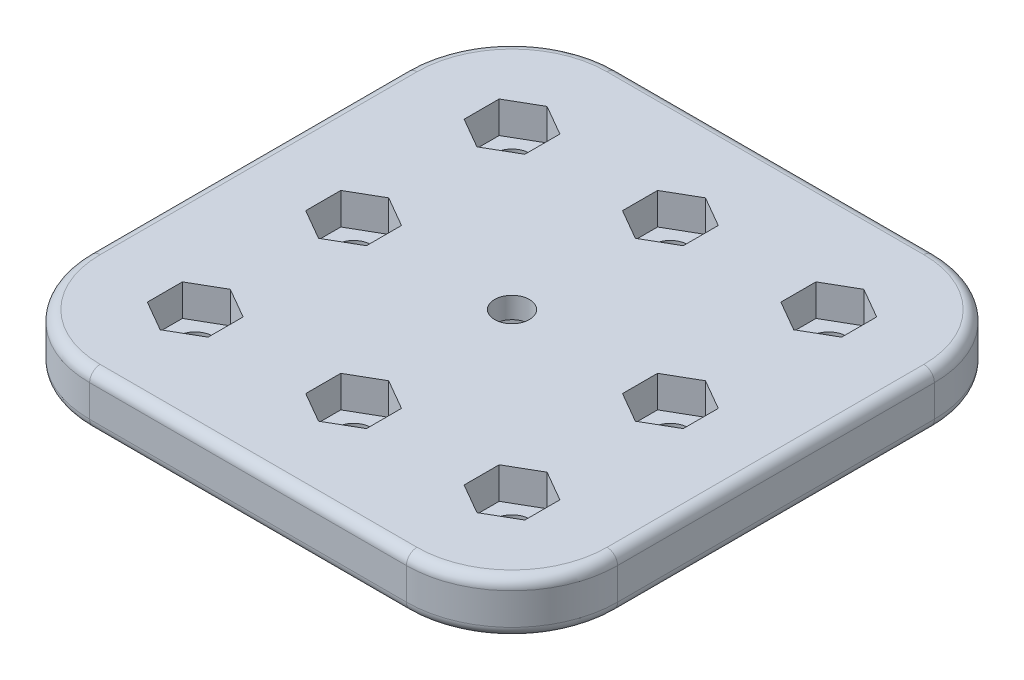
SolidWorks part; units mm, degrees
ref_plane "前视基准面" through (0, 0, 0) normal (0, 0, 1) x (1, 0, 0)
ref_plane "上视基准面" through (0, 0, 0) normal (0, 1, 0) x (1, 0, 0)
ref_plane "右视基准面" through (0, 0, 0) normal (1, 0, 0) x (0, 0, -1)
sketch "草图1" plane through (0, 0, 0) normal (0, 1, 0) x (1, 0, 0)
  line L0 (15, 18.3198) -> (12.125, 16.6599)
  line L1 (-25, 25) -> (25, 25)
  line L2 (-25, 25) -> (-25, -25)
  line L3 (-25, -25) -> (25, -25)
  line L4 (25, 25) -> (25, -25)
  line L5 (-25, 25) -> (25, -25) construction
  line L6 (-25, -25) -> (25, 25) construction
  line L7 (0, -3.3198) -> (2.875, -1.6599)
  line L8 (2.875, -1.6599) -> (2.875, 1.6599)
  line L9 (2.875, 1.6599) -> (0, 3.3198)
  line L10 (0, 3.3198) -> (-2.875, 1.6599)
  line L11 (-2.875, 1.6599) -> (-2.875, -1.6599)
  line L12 (-2.875, -1.6599) -> (0, -3.3198)
  line L13 (0, 11.6802) -> (2.875, 13.3401)
  line L14 (2.875, 13.3401) -> (2.875, 16.6599)
  line L15 (2.875, 16.6599) -> (0, 18.3198)
  line L16 (0, 18.3198) -> (-2.875, 16.6599)
  line L17 (-2.875, 16.6599) -> (-2.875, 13.3401)
  line L18 (-2.875, 13.3401) -> (0, 11.6802)
  line L19 (12.125, 16.6599) -> (12.125, 13.3401)
  line L20 (12.125, 13.3401) -> (15, 11.6802)
  line L21 (15, 11.6802) -> (17.875, 13.3401)
  line L22 (17.875, 16.6599) -> (15, 18.3198)
  line L23 (17.875, 13.3401) -> (17.875, 16.6599)
  line L24 (15, 3.3198) -> (12.125, 1.6599)
  line L25 (12.125, 1.6599) -> (12.125, -1.6599)
  line L26 (12.125, -1.6599) -> (15, -3.3198)
  line L27 (15, -3.3198) -> (17.875, -1.6599)
  line L28 (17.875, 1.6599) -> (15, 3.3198)
  line L29 (17.875, -1.6599) -> (17.875, 1.6599)
  line L30 (15, -11.6802) -> (12.125, -13.3401)
  line L31 (12.125, -13.3401) -> (12.125, -16.6599)
  line L32 (12.125, -16.6599) -> (15, -18.3198)
  line L33 (15, -18.3198) -> (17.875, -16.6599)
  line L34 (17.875, -13.3401) -> (15, -11.6802)
  line L35 (17.875, -16.6599) -> (17.875, -13.3401)
  line L36 (0, 3.3198) -> (-2.875, 1.6599)
  line L37 (-2.875, 1.6599) -> (-2.875, -1.6599)
  line L38 (-2.875, -1.6599) -> (0, -3.3198)
  line L39 (0, -3.3198) -> (2.875, -1.6599)
  line L40 (2.875, 1.6599) -> (0, 3.3198)
  line L41 (2.875, -1.6599) -> (2.875, 1.6599)
  line L42 (0, -11.6802) -> (-2.875, -13.3401)
  line L43 (-2.875, -13.3401) -> (-2.875, -16.6599)
  line L44 (-2.875, -16.6599) -> (0, -18.3198)
  line L45 (0, -18.3198) -> (2.875, -16.6599)
  line L46 (2.875, -13.3401) -> (0, -11.6802)
  line L47 (2.875, -16.6599) -> (2.875, -13.3401)
  line L48 (-17.875, 13.3401) -> (-15, 11.6802)
  line L49 (-17.875, 16.6599) -> (-17.875, 13.3401)
  line L50 (-15, 18.3198) -> (-17.875, 16.6599)
  line L51 (-12.125, 16.6599) -> (-15, 18.3198)
  line L52 (-15, 11.6802) -> (-12.125, 13.3401)
  line L53 (-12.125, 13.3401) -> (-12.125, 16.6599)
  line L54 (-17.875, -1.6599) -> (-15, -3.3198)
  line L55 (-17.875, 1.6599) -> (-17.875, -1.6599)
  line L56 (-15, 3.3198) -> (-17.875, 1.6599)
  line L57 (-12.125, 1.6599) -> (-15, 3.3198)
  line L58 (-15, -3.3198) -> (-12.125, -1.6599)
  line L59 (-12.125, -1.6599) -> (-12.125, 1.6599)
  line L60 (-17.875, -16.6599) -> (-15, -18.3198)
  line L61 (-17.875, -13.3401) -> (-17.875, -16.6599)
  line L62 (-15, -11.6802) -> (-17.875, -13.3401)
  line L63 (-12.125, -13.3401) -> (-15, -11.6802)
  line L64 (-15, -18.3198) -> (-12.125, -16.6599)
  line L65 (-12.125, -16.6599) -> (-12.125, -13.3401)
  line L66 (-2.875, -1.6599) -> (0, -3.3198)
  line L67 (-2.875, 1.6599) -> (-2.875, -1.6599)
  line L68 (0, 3.3198) -> (-2.875, 1.6599)
  line L69 (2.875, 1.6599) -> (0, 3.3198)
  line L70 (0, -3.3198) -> (2.875, -1.6599)
  line L71 (2.875, -1.6599) -> (2.875, 1.6599)
  line L72 (-2.875, -16.6599) -> (0, -18.3198)
  line L73 (-2.875, -13.3401) -> (-2.875, -16.6599)
  line L74 (0, -11.6802) -> (-2.875, -13.3401)
  line L75 (2.875, -13.3401) -> (0, -11.6802)
  line L76 (0, -18.3198) -> (2.875, -16.6599)
  line L77 (2.875, -16.6599) -> (2.875, -13.3401)
  circle A0 centre (0, 0) radius 2.875 construction
  circle A1 centre (0, 15) radius 2.875 construction
  point P0 (0, 0)
  dimension "D1" = 50
  dimension "D2" = 50
  dimension "D3" = 5.75
  dimension "D4" = 15
  dimension "D5" = 5.75
  dimension "D6" = 2
  dimension "D7" = 3
  dimension "D8" = 2
  dimension "D9" = 3
extrude "凸台-拉伸1" add sketch "草图1" along normal blind 5 contours L4 L1 L2 L3 L65 L64 L60 L61 L62 L63 L59 L58 L54 L55 L56 L57 L53 L52 L48 L49 L50 L51 L47 L45 L44 L43 L42 L46 L35 L33 L32 L31 L30 L34 L29 L27 L26 L25 L24 L28 L23 L21 L20 L19
fillet "圆角1" radius 10 4 edges at (25, 2.5, -25) (25, 2.5, 25) (-25, 2.5, 25) (-25, 2.5, -25)
fillet "圆角2" radius 1 16 edges at (-22.0711, 5, 22.0711) (0, 5, 25) (22.0711, 5, 22.0711) (25, 5, 0) (22.0711, 5, -22.0711) (0, 5, -25) (-22.0711, 5, -22.0711) (-25, 5, 0) (-22.0711, 0, 22.0711) (0, 0, 25) (22.0711, 0, 22.0711) (25, 0, 0) (22.0711, 0, -22.0711) (0, 0, -25) (-22.0711, 0, -22.0711) (-25, 0, 0)
sketch "草图2" plane through (0, 5, 0) normal (0, 1, 0) x (1, 0, 0)
  line L1 (0, 5.5) -> (-4.7631, 2.75)
  line L2 (-4.7631, 2.75) -> (-4.7631, -2.75)
  line L3 (-4.7631, -2.75) -> (0, -5.5)
  line L4 (0, -5.5) -> (4.7631, -2.75)
  line L5 (4.7631, -2.75) -> (4.7631, 2.75)
  line L6 (4.7631, 2.75) -> (0, 5.5)
  circle A0 centre (0, 0) radius 4.7631 construction
  circle A1 centre (0, 0) radius 1.65
  dimension "D1" = 3.3
  dimension "D2" = 5.5
extrude "凸台-拉伸2" add sketch "草图2" against normal blind 2
sketch "草图3" plane through (0, 0, 0) normal (0, -1, 0) x (1, 0, 0)
  line L0 (0, 11.6802) -> (2.875, 13.3401)
  line L1 (-15, 18.3198) -> (-17.875, 16.6599)
  line L2 (-17.875, 16.6599) -> (-17.875, 13.3401)
  line L3 (-17.875, 13.3401) -> (-15, 11.6802)
  line L4 (-15, 11.6802) -> (-12.125, 13.3401)
  line L5 (-12.125, 13.3401) -> (-12.125, 16.6599)
  line L6 (-12.125, 16.6599) -> (-15, 18.3198)
  line L7 (2.875, 13.3401) -> (2.875, 16.6599)
  line L8 (2.875, 16.6599) -> (0, 18.3198)
  line L9 (0, 18.3198) -> (-2.875, 16.6599)
  line L10 (-2.875, 16.6599) -> (-2.875, 13.3401)
  line L11 (-2.875, 13.3401) -> (0, 11.6802)
  line L12 (15, 11.6802) -> (17.875, 13.3401)
  line L13 (17.875, 13.3401) -> (17.875, 16.6599)
  line L14 (17.875, 16.6599) -> (15, 18.3198)
  line L15 (15, 18.3198) -> (12.125, 16.6599)
  line L16 (12.125, 16.6599) -> (12.125, 13.3401)
  line L17 (12.125, 13.3401) -> (15, 11.6802)
  line L24 (15, -3.3198) -> (17.875, -1.6599)
  line L25 (17.875, -1.6599) -> (17.875, 1.6599)
  line L26 (17.875, 1.6599) -> (15, 3.3198)
  line L27 (15, 3.3198) -> (12.125, 1.6599)
  line L28 (12.125, 1.6599) -> (12.125, -1.6599)
  line L29 (12.125, -1.6599) -> (15, -3.3198)
  line L30 (0, -18.3198) -> (2.875, -16.6599)
  line L31 (2.875, -16.6599) -> (2.875, -13.3401)
  line L32 (2.875, -13.3401) -> (0, -11.6802)
  line L33 (0, -11.6802) -> (-2.875, -13.3401)
  line L34 (-2.875, -13.3401) -> (-2.875, -16.6599)
  line L35 (-2.875, -16.6599) -> (0, -18.3198)
  line L36 (15, -18.3198) -> (17.875, -16.6599)
  line L37 (17.875, -16.6599) -> (17.875, -13.3401)
  line L38 (17.875, -13.3401) -> (15, -11.6802)
  line L39 (15, -11.6802) -> (12.125, -13.3401)
  line L40 (12.125, -13.3401) -> (12.125, -16.6599)
  line L41 (12.125, -16.6599) -> (15, -18.3198)
  line L42 (-15, -3.3198) -> (-12.125, -1.6599)
  line L43 (-12.125, -1.6599) -> (-12.125, 1.6599)
  line L44 (-12.125, 1.6599) -> (-15, 3.3198)
  line L45 (-15, 3.3198) -> (-17.875, 1.6599)
  line L46 (-17.875, 1.6599) -> (-17.875, -1.6599)
  line L47 (-17.875, -1.6599) -> (-15, -3.3198)
  line L48 (-15, -18.3198) -> (-12.125, -16.6599)
  line L49 (-12.125, -16.6599) -> (-12.125, -13.3401)
  line L50 (-12.125, -13.3401) -> (-15, -11.6802)
  line L51 (-15, -11.6802) -> (-17.875, -13.3401)
  line L52 (-17.875, -13.3401) -> (-17.875, -16.6599)
  line L53 (-17.875, -16.6599) -> (-15, -18.3198)
  line L54 (-2.875, 1.6599) -> (-2.875, -1.6599)
  line L55 (2.875, -1.6599) -> (2.875, 1.6599)
  line L56 (2.875, 1.6599) -> (0, 3.3198)
  line L57 (0, 3.3198) -> (-2.875, 1.6599)
  line L58 (-2.875, -1.6599) -> (0, -3.3198)
  line L59 (0, -3.3198) -> (2.875, -1.6599)
  circle A0 centre (-15, 15) radius 2.875 construction
  circle A1 centre (-15, 15) radius 1.65
  circle A2 centre (0, 15) radius 1.65
  circle A3 centre (15, 15) radius 1.65
  circle A5 centre (15, 0) radius 1.65
  circle A6 centre (0, -15) radius 1.65
  circle A7 centre (15, -15) radius 1.65
  circle A8 centre (-15, 0) radius 1.65
  circle A9 centre (-15, -15) radius 1.65
  circle A10 centre (0, 0) radius 1.65
  dimension "D1" = 3.3
  dimension "D2" = 5.75
  dimension "D3" = 3
  dimension "D4" = 3
extrude "凸台-拉伸3" add sketch "草图3" against normal blind 2
